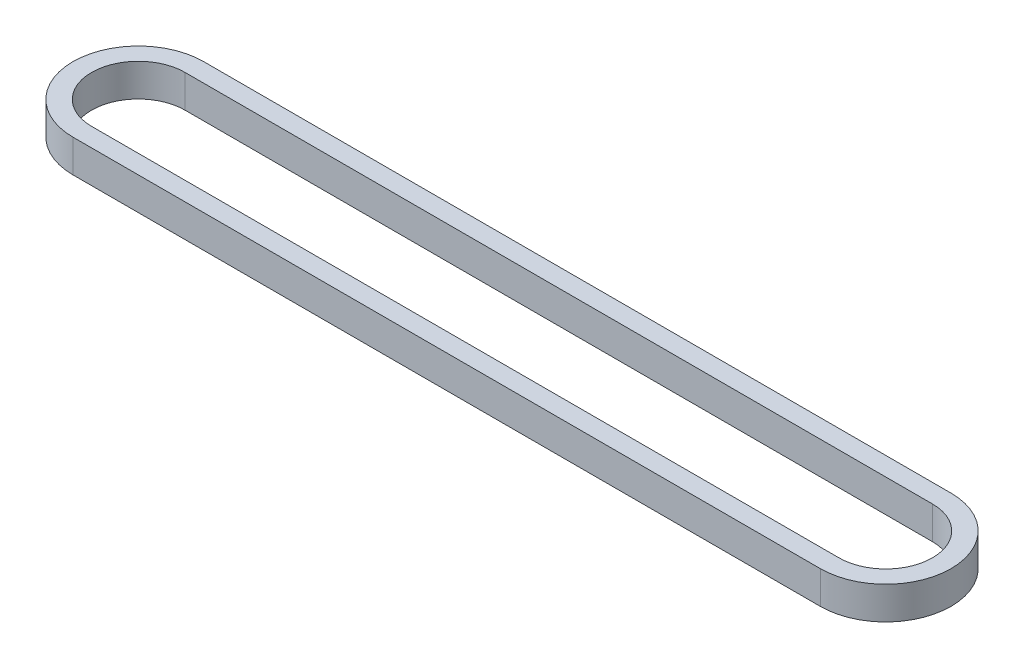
SolidWorks part; units mm, degrees
ref_plane "Front Plane" through (0, 0, 0) normal (0, 0, 1) x (1, 0, 0)
ref_plane "Top Plane" through (0, 0, 0) normal (0, 1, 0) x (1, 0, 0)
ref_plane "Right Plane" through (0, 0, 0) normal (1, 0, 0) x (0, 0, -1)
sketch "Sketch1" plane through (0, 0, 0) normal (0, 1, 0) x (1, 0, 0)
  line L0 (0, 0) -> (-80.01, 0) construction
  line L1 (0, -5) -> (-80.01, -5)
  line L2 (0, 5) -> (-80.01, 5)
  line L3 (-99.06, 0) -> (99.06, 0) construction
  line L4 (0, 0) -> (-80.01, 0) construction
  line L5 (0, -7) -> (-80.01, -7)
  line L6 (0, 7) -> (-80.01, 7)
  arc A0 (0, -5) -> (0, 5) centre (0, 0) ccw
  arc A1 (-80.01, 5) -> (-80.01, -5) centre (-80.01, 0) ccw
  arc A2 (0, -7) -> (0, 7) centre (0, 0) ccw
  arc A3 (-80.01, 7) -> (-80.01, -7) centre (-80.01, 0) ccw
  point P3 (-40.005, 0)
  point P10 (0, 0)
  point P13 (-40.005, 0)
  dimension "D1" = 5
  dimension "D2" = 198.12
  dimension "D3" = 19.05
  dimension "D4" = 2
extrude "Boss-Extrude1" add sketch "Sketch1" along normal blind 3.5
